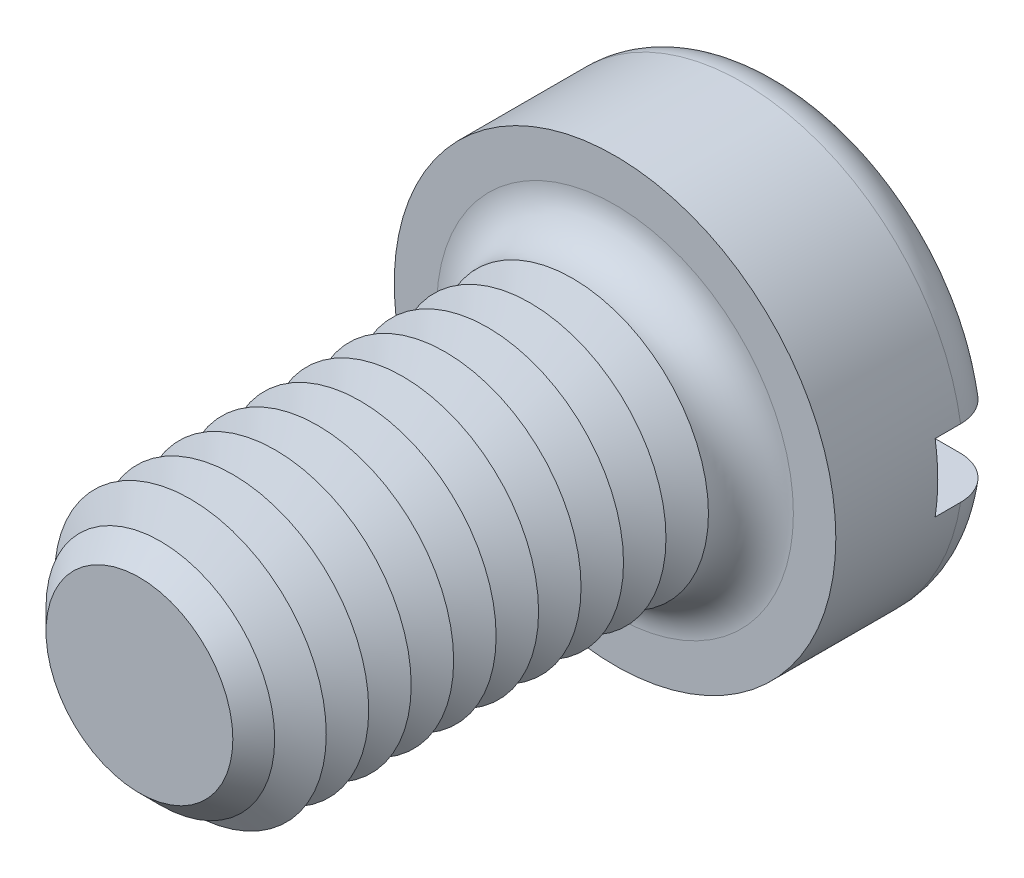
SolidWorks part; units mm, degrees
ref_plane "Front Plane" through (0, 0, 0) normal (0, 0, 1) x (1, 0, 0)
ref_plane "Top Plane" through (0, 0, 0) normal (0, 1, 0) x (1, 0, 0)
ref_plane "Right Plane" through (0, 0, 0) normal (1, 0, 0) x (0, 0, -1)
sketch "Sketch3" plane through (0, 0, 0) normal (0, 0, 1) x (1, 0, 0)
  circle A0 centre (0, 0) radius 6.5
  dimension "D1" = 13
extrude "Boss-Extrude2" add sketch "Sketch3" against normal blind 5
sketch "Sketch4" plane through (0, 0, 0) normal (0, 0, 1) x (1, 0, 0)
  circle A0 centre (0, 0) radius 4
  dimension "D1" = 8
extrude "Boss-Extrude3" add sketch "Sketch4" along normal blind 14
fillet "Fillet1" radius 1.25 2 edges at (6.5, 0, -5) (4, 0, 0)
chamfer "Chamfer1" distance 1.25 angle 45 1 edges at (4, 0, 14)
sketch "Sketch5" plane through (0, 0, 0) normal (1, 0, 0) x (0, 0, -1)
  line L0 (1.6944, 0) -> (-7.6738, 0) construction
sketch "Sketch6" plane through (0, 0, 0) normal (1, 0, 0) x (0, 0, -1)
  line L0 (-1.25, 4) -> (-1.875, 2.9175)
  line L1 (-1.875, 2.9175) -> (-2.5, 4)
  line L2 (-1.25, 4) -> (-12.75, 4) construction
  line L3 (-2.5, 4) -> (-1.25, 4)
  dimension "D1" = 1.25
revolve "Cut-Revolve1" cut sketch "Sketch6" angle 360 about L0
pattern_linear "LPattern1" count 10 spacing 1.25 along (0, 0, 1) of "Cut-Revolve1"
sketch "Sketch8" plane through (0, 0, -5) normal (0, 0, -1) x (-1, 0, 0)
  line L1 (6.5, -1) -> (-6.5, -1)
  line L2 (6.5, -1) -> (6.5, 1)
  line L3 (6.5, 1) -> (-6.5, 1)
  line L4 (-6.5, -1) -> (-6.5, 1)
  line L5 (6.5, -1) -> (-6.5, 1) construction
  line L6 (6.5, 1) -> (-6.5, -1) construction
  point P0 (0, 0)
  dimension "D1" = 13
  dimension "D2" = 2
extrude "Cut-Extrude1" cut sketch "Sketch8" against normal blind 2
